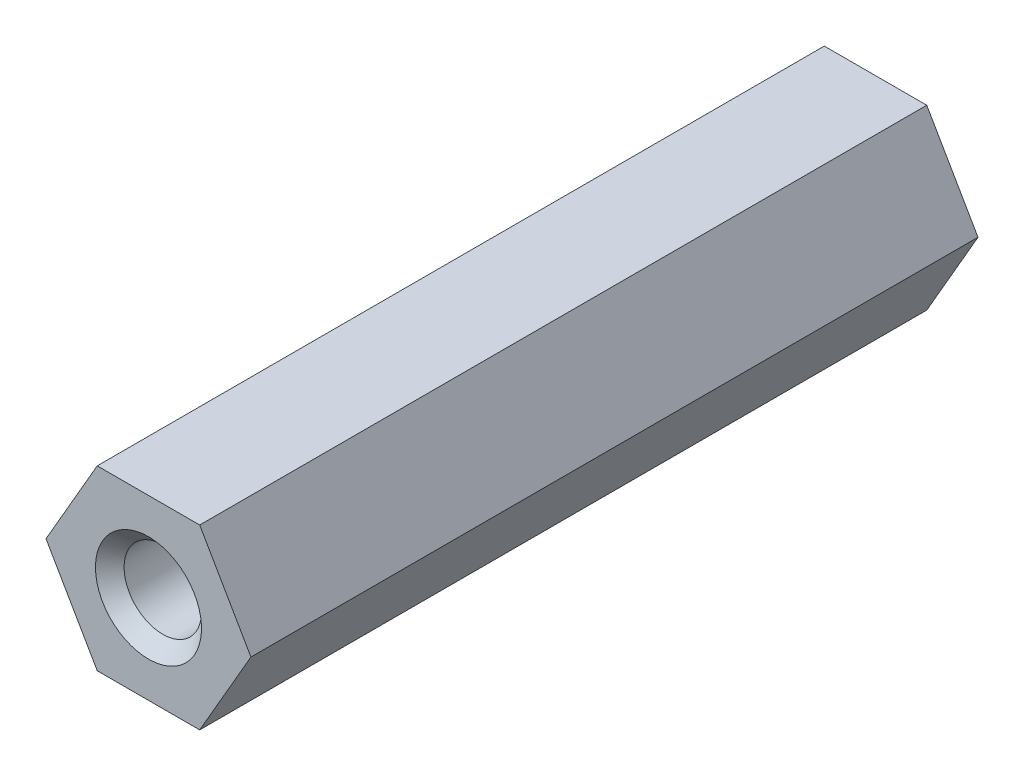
SolidWorks part; units mm, degrees
ref_plane "Front Plane" through (0, 0, 0) normal (0, 0, 1) x (1, 0, 0)
ref_plane "Top Plane" through (0, 0, 0) normal (0, 1, 0) x (1, 0, 0)
ref_plane "Right Plane" through (0, 0, 0) normal (1, 0, 0) x (0, 0, -1)
sketch "Sketch1" plane through (0, 0, 0) normal (0, 0, 1) x (1, 0, 0)
  line L1 (3.5796, 0) -> (1.7898, 3.1)
  line L2 (1.7898, 3.1) -> (-1.7898, 3.1)
  line L3 (-1.7898, 3.1) -> (-3.5796, 0)
  line L4 (-3.5796, 0) -> (-1.7898, -3.1)
  line L5 (-1.7898, -3.1) -> (1.7898, -3.1)
  line L6 (1.7898, -3.1) -> (3.5796, 0)
  circle A0 centre (0, 0) radius 3.1 construction
extrude "Extrude1" add sketch "Sketch1" against normal blind 25.4
hole_wizard "#6-32 Tapped Hole8" positions "3DSketch13" profile "Sketch27" tap size "#6-32" standard "Ansi Inch"
sketch3d "3DSketch13"
  point P0 (0.0004, 0.0007, 0)
  dimension "D1" = 3.58
  dimension "D2" = 3.58
sketch "Sketch27" plane through (0.0004, 0.0007, 0) normal (1, 0, 0) x (0, -1, 0)
  line L0 (0, 0) -> (0, 25.4)
  line L1 (0, 25.4) -> (1.3525, 25.4)
  line L2 (1.3525, 25.4) -> (1.3525, 0)
  line L5 (1.3525, 0) -> (0, 0)
  line L11 (0, -6.35) -> (0, 107.95) construction
  dimension "Thru Tap Drill Dia." = 2.7051
  dimension "Thru Tap Drill Depth" = 25.4
chamfer "Chamfer1" distance 0.5 angle 45 1 edges at (1.353, 0.0007, 0)
chamfer "Chamfer2" distance 0.5 angle 45 1 edges at (1.353, 0.0007, -25.4)
sketch "Sketch15" plane through (0, 0, 0) normal (0, 0, 1) x (1, 0, 0)
  circle A0 centre (0, 0) radius 1.5
  dimension "D1" = 3
extrude "Cut-Extrude1" cut sketch "Sketch15" against normal through all
